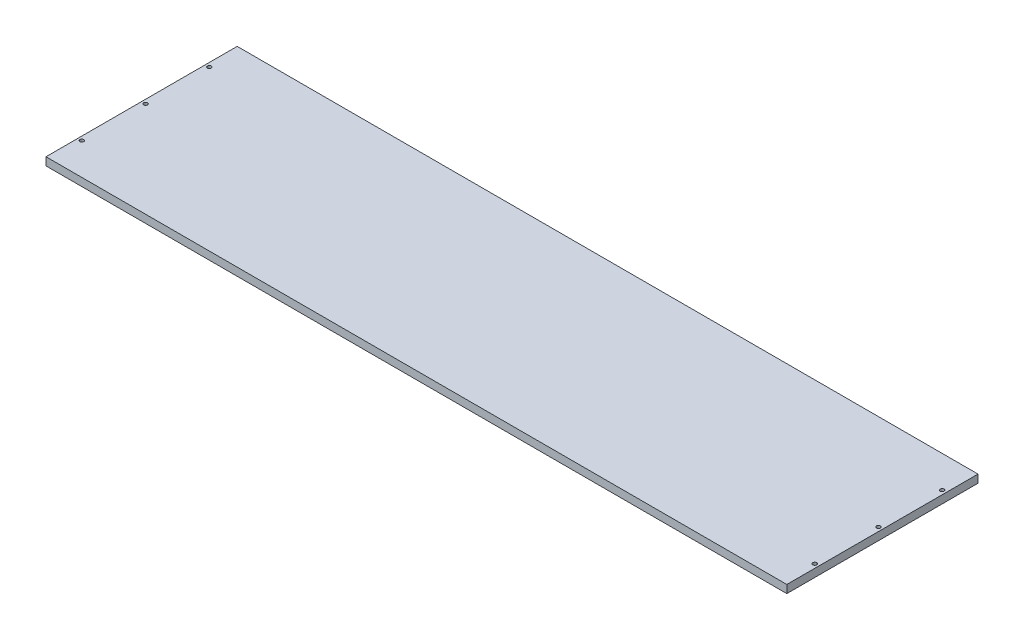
SolidWorks part; units mm, degrees
ref_plane "Front Plane" through (0, 0, 0) normal (0, 0, 1) x (1, 0, 0)
ref_plane "Top Plane" through (0, 0, 0) normal (0, 1, 0) x (1, 0, 0)
ref_plane "Right Plane" through (0, 0, 0) normal (1, 0, 0) x (0, 0, -1)
sketch "Sketch1" plane through (0, 0, 0) normal (0, 1, 0) x (1, 0, 0)
  line L1 (-295.275, -76.2) -> (295.275, -76.2)
  line L2 (-295.275, -76.2) -> (-295.275, 76.2)
  line L3 (-295.275, 76.2) -> (295.275, 76.2)
  line L4 (295.275, -76.2) -> (295.275, 76.2)
  line L5 (-295.275, -76.2) -> (295.275, 76.2) construction
  line L6 (-295.275, 76.2) -> (295.275, -76.2) construction
  point P0 (0, 0)
extrude "Boss-Extrude1" add sketch "Sketch1" along normal blind 6.35
hole_wizard "#31 (0.12) Diameter Hole1" positions "Sketch2" profile "Sketch4" hole size "#31" standard "ANSI Inch"
sketch "Sketch2" plane through (0, 6.35, 0) normal (0, 1, 0) x (1, 0, 0)
  line L0 (-295.275, 76.2) -> (-295.275, -76.2) construction
  line L1 (295.275, -76.2) -> (295.275, 76.2) construction
  line L2 (295.275, 76.2) -> (-295.275, 76.2) construction
  point P0 (-292.1, 50.8)
  point P2 (-292.1, -50.8)
  point P4 (-292.1, 0)
  point P9 (292.1, 0)
  point P11 (292.1, 50.8)
  point P13 (292.1, -50.8)
  point P20 (282.0742, -60.0395)
  dimension "D1" = 50.8
  dimension "D2" = 50.8
  dimension "D3" = 3.175
  dimension "D4" = 50.8
  dimension "D5" = 50.8
  dimension "D6" = 3.175
  dimension "D7" = 76.2
  dimension "D8" = 76.2
sketch "Sketch4" plane through (-292.1, 6.35, -50.8) normal (1, 0, 0) x (0, 0, 1)
  line L0 (0, 0) -> (0, 6.35)
  line L1 (0, 6.35) -> (1.524, 6.35)
  line L2 (1.524, 6.35) -> (1.524, 0)
  line L5 (1.524, 0) -> (0, 0)
  line L11 (0, -6.35) -> (0, 107.95) construction
  dimension "Thru Hole Dia." = 3.048
  dimension "Thru Hole Depth" = 6.35
